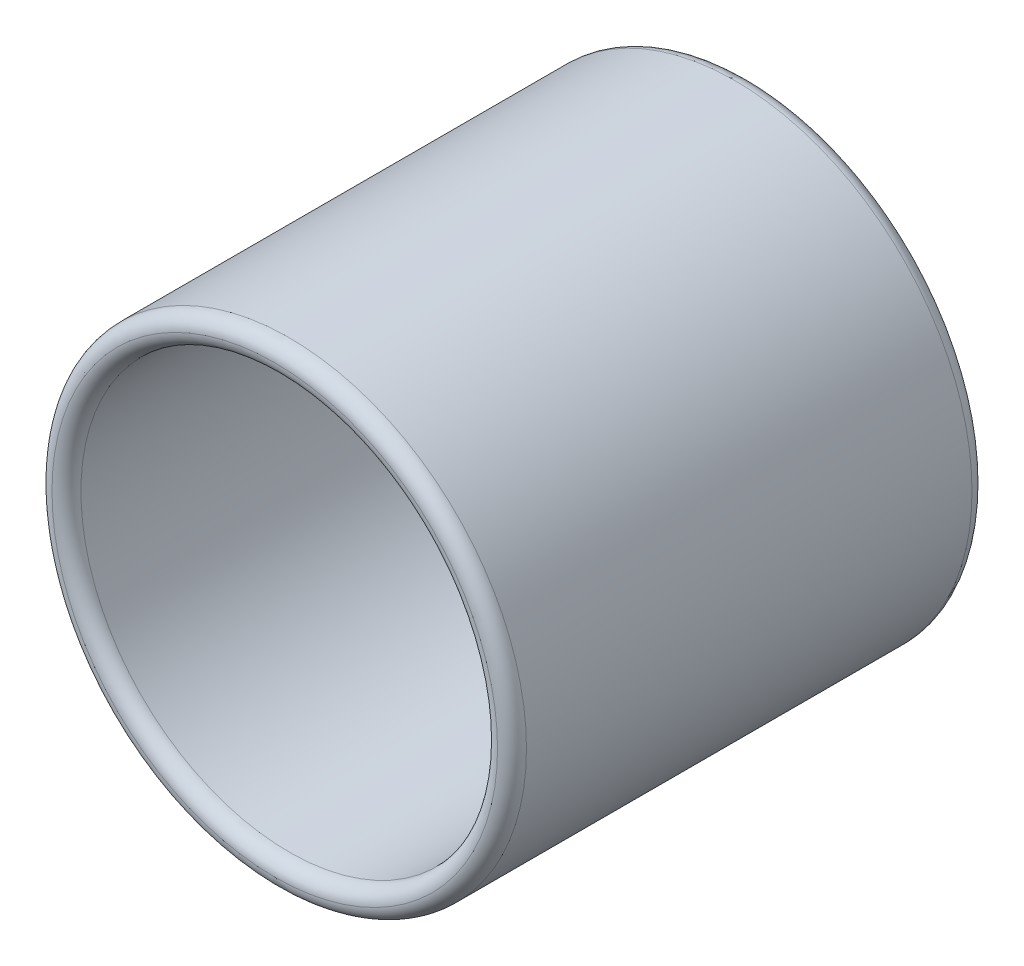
SolidWorks part; units mm, degrees
ref_plane "正面" through (0, 0, 0) normal (0, 0, 1) x (1, 0, 0)
ref_plane "平面" through (0, 0, 0) normal (0, 1, 0) x (1, 0, 0)
ref_plane "右側面" through (0, 0, 0) normal (1, 0, 0) x (0, 0, -1)
sketch "ｽｹｯﾁ1" plane through (0, 0, 0) normal (0, 0, 1) x (1, 0, 0)
  circle A0 centre (0, 0) radius 4.1
  circle A1 centre (0, 0) radius 3.6
  dimension "D1" = 8.2
  dimension "D2" = 7.2
extrude "ﾎﾞｽ - 押し出し1" add sketch "ｽｹｯﾁ1" along normal blind 8.2
fillet "ﾌｨﾚｯﾄ1" radius 0.25 4 edges at (3.6, 0, 0) (4.1, 0, 0) (4.1, 0, 8.2) (3.6, 0, 8.2)
